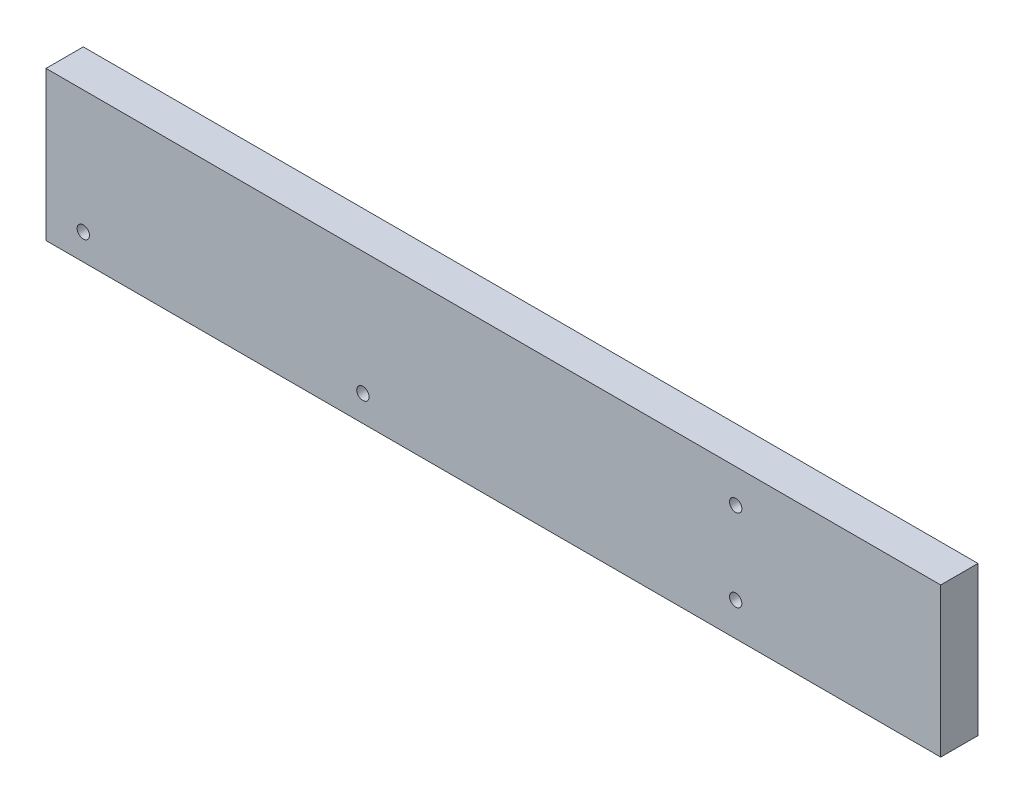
SolidWorks part; units mm, degrees
ref_plane "Plan de face" through (0, 0, 0) normal (0, 0, 1) x (1, 0, 0)
ref_plane "Plan de dessus" through (0, 0, 0) normal (0, 1, 0) x (1, 0, 0)
ref_plane "Plan de droite" through (0, 0, 0) normal (1, 0, 0) x (0, 0, -1)
sketch "Esquisse1" plane through (0, 0, 0) normal (0, 0, 1) x (1, 0, 0)
  line L1 (-47.5, 20) -> (192.5, 20)
  line L2 (-47.5, 20) -> (-47.5, -20)
  line L3 (-47.5, -20) -> (192.5, -20)
  line L4 (192.5, 20) -> (192.5, -20)
  dimension "D1" = 240
  dimension "D2" = 40
  dimension "D3" = 47.5
  dimension "D4" = 20
extrude "Extrusion1" add sketch "Esquisse1" along normal mid plane 10
hole_wizard "Trou taraudé M4x0.71" positions "Esquisse3" profile "Esquisse2" tap size "M4x0.7" standard "ISO"
sketch "Esquisse3" plane through (0, 0, 5) normal (0, 0, 1) x (1, 0, 0)
  line L0 (-47.5, -20) -> (192.5, -20) construction
  line L1 (-47.5, 20) -> (-47.5, -20) construction
  point P0 (-37.5, -13)
  point P1 (37.5, -13)
  point P6 (137.5, -11)
  point P7 (137.5, 11)
  dimension "D1" = 7
  dimension "D2" = 10
  dimension "D3" = 75
  dimension "D4" = 185
  dimension "D5" = 9
  dimension "D6" = 22
sketch "Esquisse2" plane through (-37.5, -13, 5) normal (1, 0, 0) x (0, -1, 0)
  line L0 (0, 0) -> (0, 10)
  line L1 (0, 10) -> (1.65, 10)
  line L2 (1.65, 10) -> (1.65, 0)
  line L5 (1.65, 0) -> (0, 0)
  line L11 (0, -6.35) -> (0, 107.95) construction
  dimension "Diamètre du trou pour taraudage jusqu'au prochain" = 3.3
  dimension "Profondeur du trou pour taraudage jusqu'au prochain" = 10
